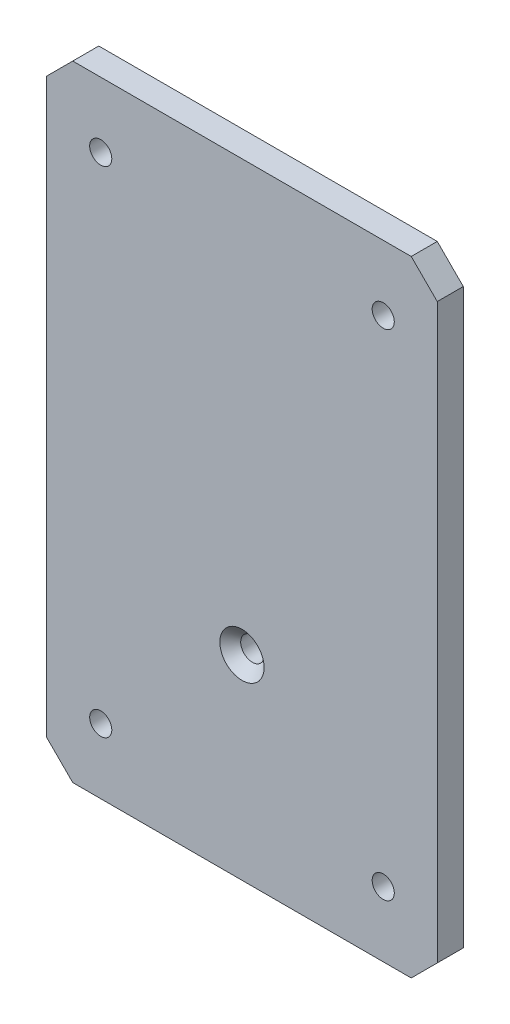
SolidWorks part; units mm, degrees
ref_plane "Face" through (0, 0, 0) normal (0, 0, 1) x (1, 0, 0)
ref_plane "Dessus" through (0, 0, 0) normal (0, 1, 0) x (1, 0, 0)
ref_plane "Droite" through (0, 0, 0) normal (1, 0, 0) x (0, 0, -1)
sketch "Esquisse1" plane through (0, 0, 0) normal (0, 0, 1) x (1, 0, 0)
  line L0 (150, 230) -> (140, 240)
  line L1 (10, 0) -> (140, 0)
  line L2 (0, 10) -> (0, 230)
  line L3 (10, 240) -> (140, 240)
  line L4 (150, 10) -> (150, 230)
  line L5 (0, 230) -> (10, 240)
  line L6 (10, 0) -> (0, 10)
  line L7 (140, 0) -> (150, 10)
  line L8 (75, 254.4979) -> (75, -37.5897) construction
  circle A0 centre (20.75, 215) radius 4.25
  circle A1 centre (129.25, 215) radius 4.25
  circle A2 centre (20.75, 25) radius 4.25
  circle A3 centre (129.25, 25) radius 4.25
  circle A4 centre (75, 75) radius 4.5
  point P0 (0, 0)
  point P1 (150, 240)
  point P2 (0, 240)
  point P3 (150, 0)
  dimension "D3" = 25
  dimension "D9" = 8.5
  dimension "D10" = 8.5
  dimension "D11" = 8.5
  dimension "D12" = 8.5
  dimension "D13" = 190
  dimension "D14" = 108.5
  dimension "D16" = 75
  dimension "D17" = 9
  dimension "D1" = 150
  dimension "D2" = 240
  dimension "D5" = 10
  dimension "D6" = 10
  dimension "D7" = 10
  dimension "D8" = 10
  dimension "D15" = 75
extrude "Base-Extrusion" add sketch "Esquisse1" along normal blind 10
chamfer "Chanfrein1" distance 4 angle 45 1 edges at (79.5, 75, 10)
ref_plane "Plan longitudinal" through (75, 0, 0) normal (1, 0, 0) x (0, 0, -1)
